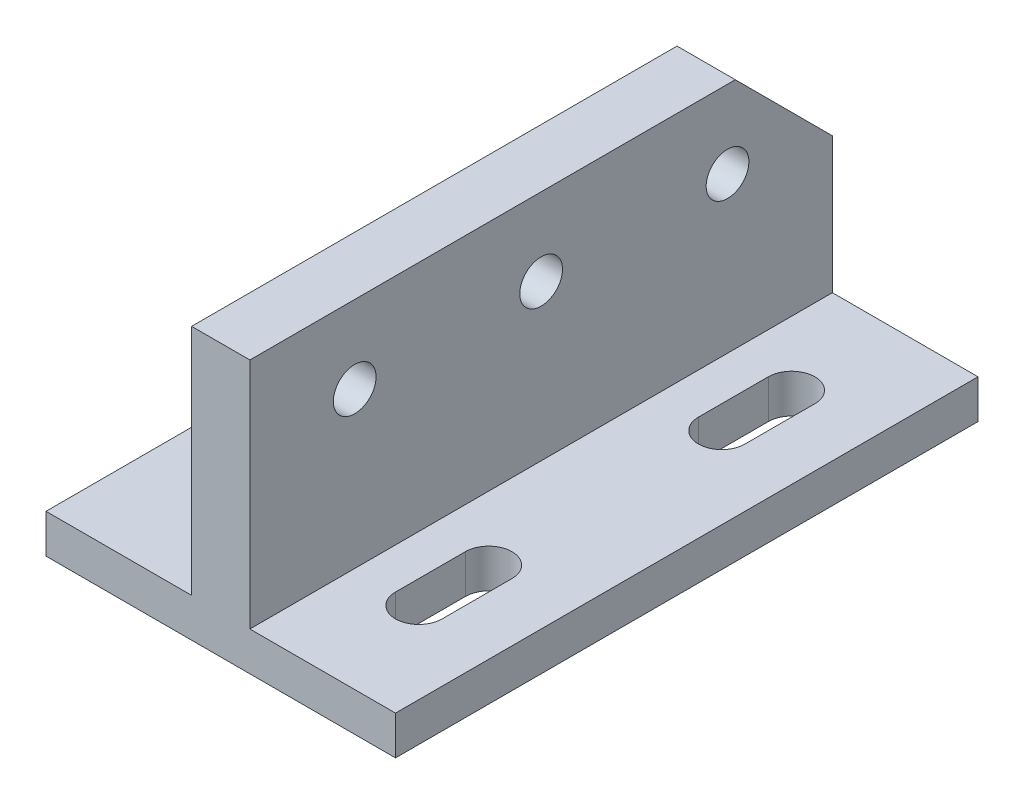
SolidWorks part; units mm, degrees
other "DetailItem5"
other "DetailItem6"
other "DetailItem7"
other "DetailItem8"
other "DetailItem9"
other "DetailItem10"
other "DetailItem11"
other "DetailItem12"
other "DetailItem13"
other "DetailItem14"
other "DetailItem15"
other "DetailItem16"
other "DetailItem17"
other "DetailItem18"
other "DetailItem19"
other "DetailItem20"
other "DetailItem21"
other "DetailItem22"
ref_plane "Front Plane" through (0, 0, 0) normal (0, 0, 1) x (1, 0, 0)
ref_plane "Top Plane" through (0, 0, 0) normal (0, 1, 0) x (1, 0, 0)
ref_plane "Right Plane" through (0, 0, 0) normal (1, 0, 0) x (0, 0, -1)
sketch "Sketch1" plane through (0, 0, 0) normal (0, 0, 1) x (1, 0, 0)
  line L0 (0, 35) -> (0, 0) construction
  line L1 (-22.5, 0) -> (22.5, 0)
  line L2 (-22.5, 0) -> (-22.5, 5)
  line L3 (-22.5, 5) -> (-3.75, 5)
  line L4 (22.5, 0) -> (22.5, 5)
  line L5 (-3.75, 35) -> (3.75, 35)
  line L6 (-3.75, 35) -> (-3.75, 5)
  line L8 (3.75, 35) -> (3.75, 5)
  line L9 (3.75, 5) -> (22.5, 5)
  dimension "D1" = 45
  dimension "D2" = 5
  dimension "D3" = 7.5
  dimension "D4" = 35
extrude "Boss-Extrude1" add sketch "Sketch1" against normal blind 75
sketch "Sketch3" plane through (0, 5, 0) normal (0, 1, 0) x (1, 0, 0)
  line L0 (12, 22.5) -> (12, 13.5) construction
  line L1 (15, 22.5) -> (15, 13.5)
  line L2 (9, 22.5) -> (9, 13.5)
  line L3 (22.5, 0) -> (3.75, 0) construction
  line L4 (0, 0) -> (0, 75) construction
  line L5 (3.75, 75) -> (-3.75, 75) construction
  line L6 (-12, 22.5) -> (-12, 13.5) construction
  line L7 (-15, 22.5) -> (-15, 13.5)
  line L8 (-9, 22.5) -> (-9, 13.5)
  line L9 (22.5, 37.5) -> (-22.5, 37.5) construction
  line L10 (22.5, 75) -> (22.5, 0) construction
  line L11 (-22.5, 75) -> (-22.5, 0) construction
  line L12 (-12, 52.5) -> (-12, 61.5) construction
  line L13 (-15, 52.5) -> (-15, 61.5)
  line L14 (-9, 52.5) -> (-9, 61.5)
  line L15 (12, 52.5) -> (12, 61.5) construction
  line L16 (15, 52.5) -> (15, 61.5)
  line L17 (9, 52.5) -> (9, 61.5)
  arc A0 (15, 22.5) -> (9, 22.5) centre (12, 22.5) ccw
  arc A1 (9, 13.5) -> (15, 13.5) centre (12, 13.5) ccw
  arc A2 (-15, 22.5) -> (-9, 22.5) centre (-12, 22.5) cw
  arc A3 (-9, 13.5) -> (-15, 13.5) centre (-12, 13.5) cw
  arc A4 (-15, 52.5) -> (-9, 52.5) centre (-12, 52.5) ccw
  arc A5 (-9, 61.5) -> (-15, 61.5) centre (-12, 61.5) ccw
  arc A6 (15, 52.5) -> (9, 52.5) centre (12, 52.5) cw
  arc A7 (9, 61.5) -> (15, 61.5) centre (12, 61.5) cw
  point P2 (12, 18)
  point P16 (-12, 18)
  point P29 (-12, 57)
  point P36 (12, 57)
  dimension "D1" = 6
  dimension "D2" = 9
  dimension "D3" = 12
  dimension "D4" = 18
extrude "Cut-Extrude1" cut sketch "Sketch3" against normal through all
hole_wizard "Ø5.5 (5.5) Diameter Hole1" positions "Sketch4" profile "Sketch5" hole size "Ø5.5" standard "ANSI Metric"
sketch "Sketch4" plane through (3.75, 0, 0) normal (1, 0, 0) x (0, 0, -1)
  line L0 (0, 25) -> (75, 25) construction
  line L1 (0, 5) -> (0, 35) construction
  line L2 (75, 5) -> (75, 35) construction
  line L3 (75, 0) -> (0, 0) construction
  point P10 (37.5, 25)
  point P12 (13.5, 25)
  point P14 (61.5, 25)
  dimension "D1" = 25
  dimension "D2" = 24
  dimension "D3" = 24
sketch "Sketch5" plane through (3.75, 25, -61.5) normal (0, 1, 0) x (0, 0, -1)
  line L0 (0, 0) -> (0, 26.25)
  line L1 (0, 26.25) -> (2.75, 26.25)
  line L2 (2.75, 26.25) -> (2.75, 0)
  line L5 (2.75, 0) -> (0, 0)
  line L11 (0, -6.35) -> (0, 107.95) construction
  dimension "Thru Hole Dia." = 5.5
  dimension "Thru Hole Depth" = 26.25
chamfer "Chamfer1" distance 12.5 angle 45 1 edges at (0, 35, -75)
